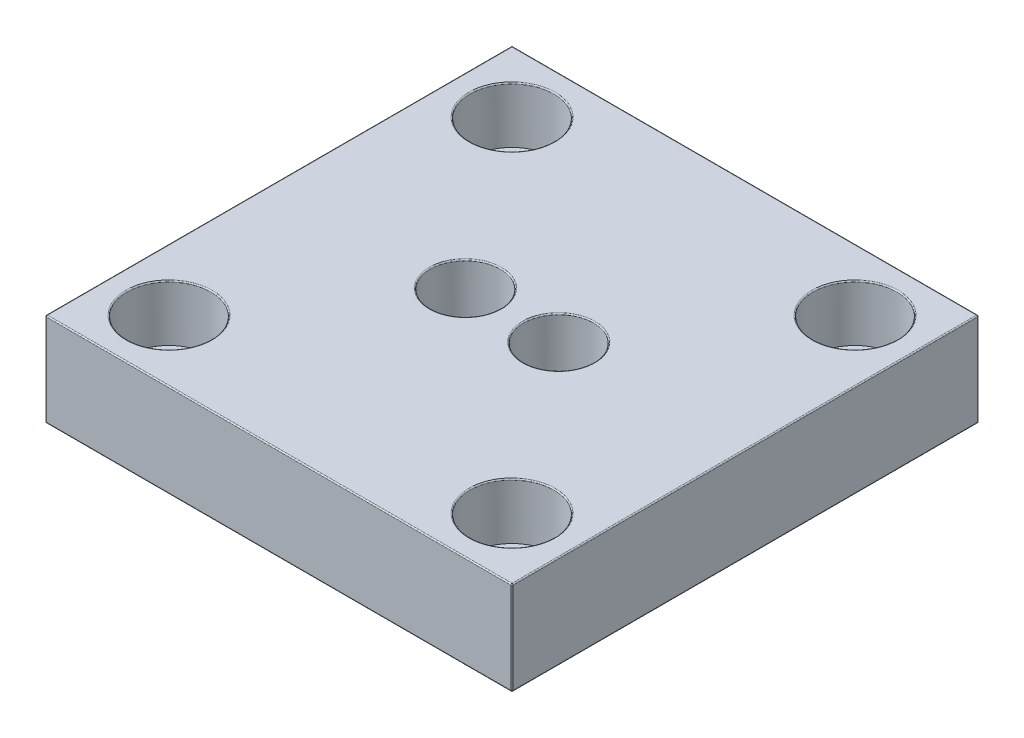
SolidWorks part; units mm, degrees
ref_plane "Front Plane" through (0, 0, 0) normal (0, 0, 1) x (1, 0, 0)
ref_plane "Top Plane" through (0, 0, 0) normal (0, 1, 0) x (1, 0, 0)
ref_plane "Right Plane" through (0, 0, 0) normal (1, 0, 0) x (0, 0, -1)
sketch "Sketch1" plane through (0, 0, 0) normal (0, 1, 0) x (1, 0, 0)
  line L1 (0, 0) -> (100, 0)
  line L2 (0, 0) -> (0, 100)
  line L3 (0, 100) -> (100, 100)
  line L4 (100, 0) -> (100, 100)
  dimension "D1" = 100
  dimension "D2" = 100
extrude "Boss-Extrude1" add sketch "Sketch1" along normal blind 20
sketch "Sketch2" plane through (0, 20, 0) normal (0, 1, 0) x (-1, 0, 0)
  line L0 (-50, -100) -> (-50, 0) construction
  line L1 (-100, -100) -> (0, -100) construction
  line L2 (0, 0) -> (-100, 0) construction
  line L4 (-100, 0) -> (-100, -100) construction
  line L5 (-100, -50) -> (0, -50) construction
  line L6 (0, -100) -> (0, 0) construction
  circle A0 centre (-40, -50) radius 4.5
  circle A1 centre (-13.25, -86.75) radius 5.25
  circle A2 centre (-13.25, -13.25) radius 5.25
  circle A3 centre (-86.75, -13.25) radius 5.25
  circle A4 centre (-60, -50) radius 4.5
  circle A5 centre (-86.75, -86.75) radius 5.25
  dimension "D1" = 9
  dimension "D2" = 10.5
  dimension "D3" = 10.5
  dimension "D4" = 10
  dimension "D5" = 36.75
  dimension "D6" = 36.75
  dimension "D7" = 73.5
  dimension "D8" = 36.75
extrude "Cut-Extrude1" cut sketch "Sketch2" against normal through all
sketch "Sketch3" plane through (0, 20, 0) normal (0, 1, 0) x (1, 0, 0)
  circle A0 centre (40, 50) radius 7.5
  circle A1 centre (60, 50) radius 7.5
  circle A2 centre (86.75, 86.75) radius 9
  circle A3 centre (13.25, 86.75) radius 9
  circle A4 centre (13.25, 13.25) radius 9
  circle A5 centre (86.75, 13.25) radius 9
  dimension "D1" = 18
  dimension "D2" = 15
  dimension "D3" = 18
  dimension "D4" = 15
  dimension "D5" = 18
  dimension "D6" = 18
extrude "Cut-Extrude2" cut sketch "Sketch3" against normal blind 12
fillet "Fillet1" radius 0.25 24 edges at (40, 0, -45.5) (13.25, 0, -81.5) (13.25, 0, -8) (86.75, 0, -18.5) (60, 0, -54.5) (86.75, 0, -92) (0, 0, -50) (0, 10, -100) (50, 0, -100) (100, 10, -100) (100, 0, -50) (0, 10, 0) (100, 10, 0) (50, 0, 0) (50, 20, -100) (100, 20, -50) (50, 20, 0) (0, 20, -50) (40, 20, -42.5) (60, 20, -42.5) (86.75, 20, -77.75) (13.25, 20, -77.75) (13.25, 20, -4.25) (86.75, 20, -4.25)
